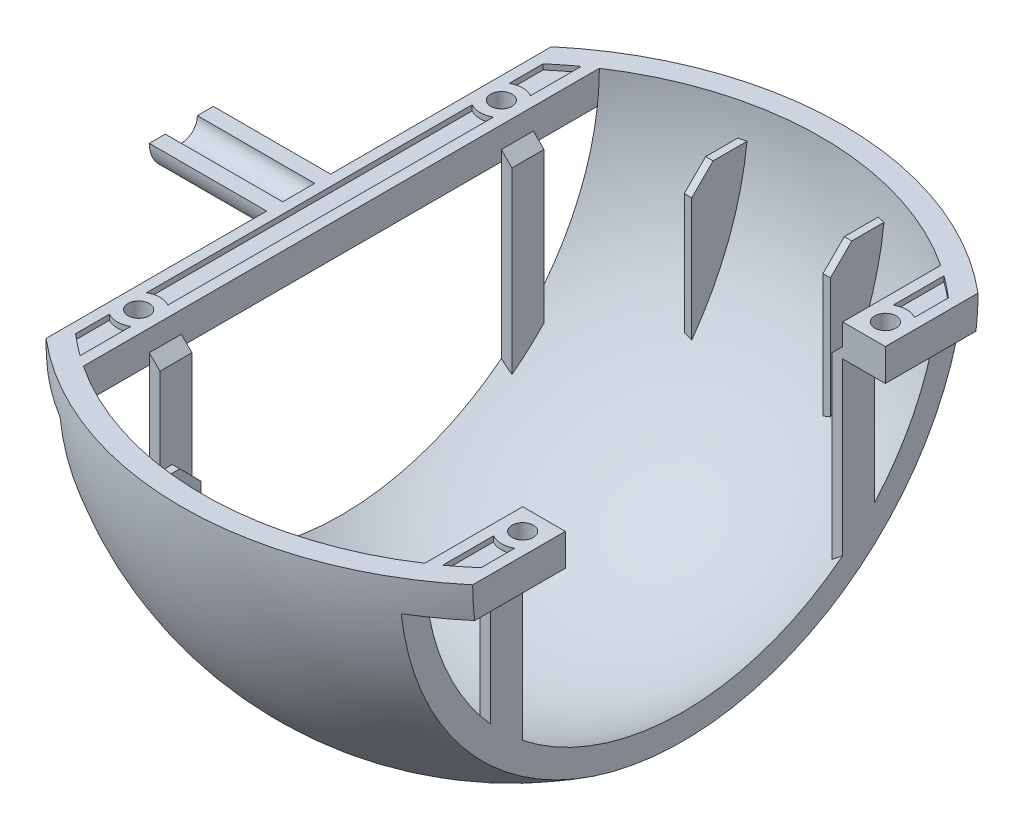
SolidWorks part; units mm, degrees
ref_plane "Plan de face" through (0, 0, 0) normal (0, 0, 1) x (1, 0, 0)
ref_plane "Plan de dessus" through (0, 0, 0) normal (0, 1, 0) x (1, 0, 0)
ref_plane "Plan de droite" through (0, 0, 0) normal (1, 0, 0) x (0, 0, -1)
imported_body "Stock-Base boitier-1"
ref_plane "Plan1" through (0, -2, 0) normal (0, 1, 0) x (-1, 0, 0)
sketch "Esquisse1" plane through (0, -2, 0) normal (0, 1, 0) x (-1, 0, 0)
  line L0 (0, 0) -> (0, 32.3405) construction
  line L1 (15, 15) -> (15, 18)
  line L2 (16, 15) -> (15, 15)
  line L3 (16, 18) -> (16, 15)
  line L4 (-15, 18) -> (-16, 18)
  line L5 (-16, 18) -> (-16, 15)
  line L6 (-16, 15) -> (-15, 15)
  line L7 (-15, 15) -> (-15, 18)
  line L8 (-15, 18) -> (-16, 18) construction
  line L9 (-16, 18) -> (-16, 15) construction
  line L10 (-16, 15) -> (-15, 15) construction
  line L11 (-15, 15) -> (-15, 18) construction
  line L12 (15, 18) -> (16, 18)
  dimension "D1" = 0
extrude "Extrusion1" add sketch "Esquisse1" against normal up to next
chamfer "Chanfrein1" distance 1 angle 45 1 edges at (-15, -2, 16.5)
ref_plane "Plan2" through (6.5, 0, 0) normal (1, 0, 0) x (0, 0, -1)
sketch "Esquisse2" plane through (6.5, 0, 0) normal (1, 0, 0) x (0, 0, -1)
  line L0 (-27.9286, -3) -> (-25, -3)
  line L1 (-23.4947, -3) -> (-15, -3) construction
  line L2 (-23, -5) -> (-23, -17.0139)
  line L3 (24, -3) -> (-15, -3) construction
  line L4 (-25, -3) -> (-23, -5)
  point P1 (-23, -3)
  dimension "D1" = 23
  dimension "D4" = 2
rib "Nervure1" sketch "Esquisse2" sketch "Esquisse2" thickness 0.7 extrusion direction parallel to sketch draft on no parameters "D1"=0.7
mirror "Symétrie1" about plane through (0, 0, 0) normal (1, 0, 0) of "Nervure1"
mirror "Symétrie2" about plane through (0, 0, 0) normal (0, 0, 1) of "Chanfrein1", "Symétrie1", "Extrusion1", "Nervure1"
